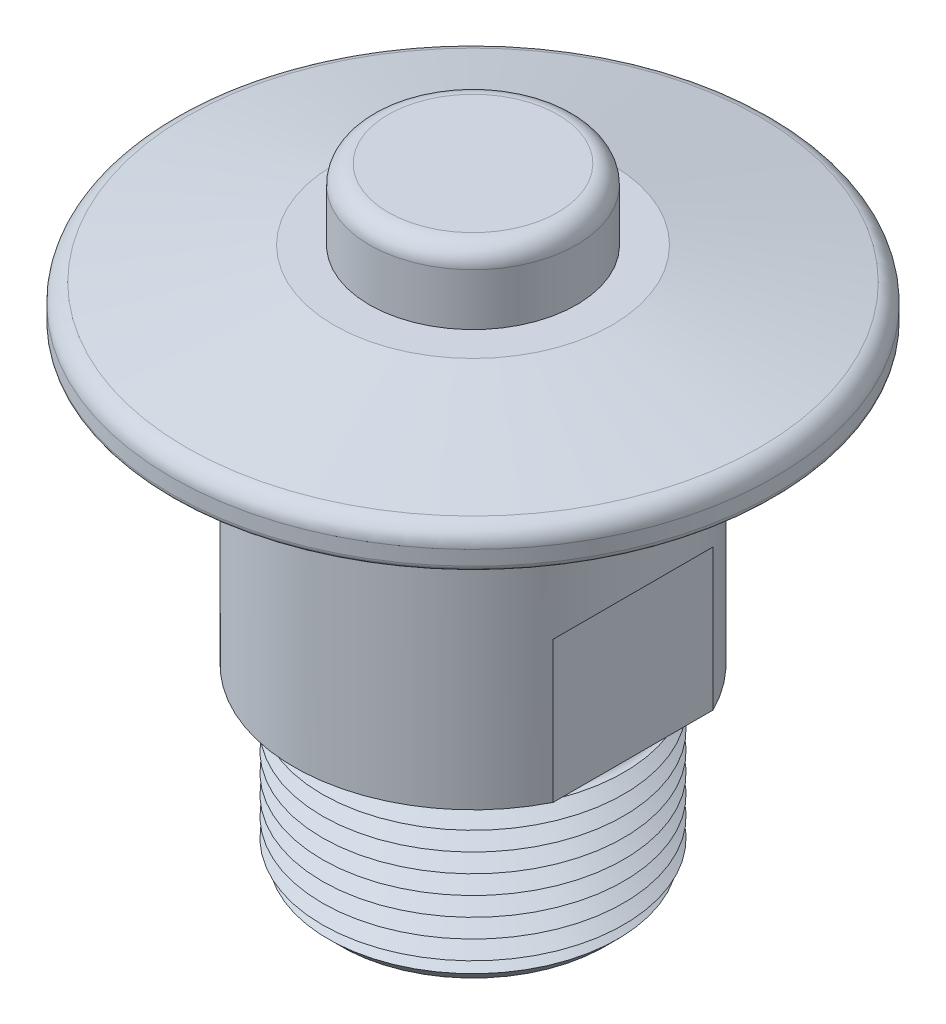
SolidWorks part; units mm, degrees
ref_plane "Front Plane" through (0, 0, 0) normal (0, 0, 1) x (1, 0, 0)
ref_plane "Top Plane" through (0, 0, 0) normal (0, 1, 0) x (1, 0, 0)
ref_plane "Right Plane" through (0, 0, 0) normal (1, 0, 0) x (0, 0, -1)
sketch "Sketch2" plane through (0, 0, 0) normal (0, 1, 0) x (1, 0, 0)
  circle A0 centre (0, 0) radius 9.5
  dimension "D1" = 19
extrude "Boss-Extrude1" add sketch "Sketch2" against normal blind 15.5
sketch "Sketch5" plane through (0, -15.5, 0) normal (0, -1, 0) x (1, 0, 0)
  circle A0 centre (0, 0) radius 8
  dimension "D1" = 16
extrude "Boss-Extrude3" add sketch "Sketch5" along normal blind 9.5
chamfer "Chamfer1" distance 1 angle 45 1 edges at (0, -25, -8)
sketch "Sketch7" plane through (0, 0, 0) normal (1, 0, 0) x (0, 0, -1)
  line L0 (0, -2.3362) -> (0, -32.4373) construction
sketch "Sketch9" plane through (0, 0, 0) normal (1, 0, 0) x (0, 0, -1)
  line L0 (-8, -15.5) -> (-8, -24) construction
  line L1 (-8, -15.5) -> (-8, -16.5)
  arc A0 (-8, -16.5) -> (-8, -15.5) centre (-8, -16) ccw
  point P1 (-8, -15.5)
  point P7 (-8, -15.5)
  dimension "D1" = 1
revolve "Cut-Revolve1" cut sketch "Sketch9" angle 360 about L0
sketch "Sketch10" plane through (0, 0, 0) normal (1, 0, 0) x (0, 0, -1)
  line L0 (-8, -16.5) -> (-7.134, -17)
  line L1 (-7.134, -17) -> (-8, -17.5)
  line L2 (-8, -16.5) -> (-8, -24) construction
  line L3 (-8, -17.5) -> (-8, -16.5)
  dimension "D1" = 1
revolve "Cut-Revolve2" cut sketch "Sketch10" angle 360 about L0
pattern_linear "LPattern1" count 8 spacing 1 along (0, -1, 0) of "Cut-Revolve2"
sketch "Sketch11" plane through (0, -25, 0) normal (0, -1, 0) x (1, 0, 0)
  circle A0 centre (0, 0) radius 3
  dimension "D1" = 6
extrude "Cut-Extrude2" cut sketch "Sketch11" against normal blind 6
chamfer "Chamfer3" distance 0.5 angle 45 1 edges at (0, -25, -3)
sketch "Sketch12" plane through (0, -19, 0) normal (0, -1, 0) x (1, 0, 0)
  circle A0 centre (0, 0) radius 3
  circle A1 centre (0, 0) radius 3 construction
extrude "Cut-Extrude3" cut sketch "Sketch12" against normal through all draft 30
ref_plane "Plane1" through (0, -22, 0) normal (0, -1, 0) x (-1, 0, 0)
sketch "Sketch14" plane through (0, -22, 0) normal (0, -1, 0) x (-1, 0, 0)
  line L0 (-2, 0) -> (-4, 0)
  arc A0 (-2, 0) -> (-4, 0) centre (-3, 0) ccw
  circle A1 centre (0, 0) radius 3 construction
  circle A2 centre (0, 0) radius 3 construction
  point P2 (-3, 0)
  point P8 (-3, 0)
  dimension "D1" = 2
revolve "Revolve2" add sketch "Sketch14" angle 360 about L0
pattern_circular "CirPattern1" count 4 over 360 about axis through (0, 0, 0) along (0, 1, 0) of "Revolve2"
sketch "Sketch15" plane through (0, 0, 0) normal (1, 0, 0) x (0, 0, -1)
  line L0 (0, 0) -> (-16, 0)
  line L1 (-16, 0) -> (-16, 1.875)
  line L2 (-16, 1.875) -> (-7.375, 3.75)
  line L3 (-7.375, 3.75) -> (-5.5, 3.75)
  line L4 (-5.5, 3.75) -> (-5.5, 7.5)
  line L5 (-5.5, 7.5) -> (0, 7.5)
  line L6 (0, 7.5) -> (0, 0)
  line L7 (0, -2.3362) -> (0, -32.4373) construction
  dimension "D1" = 16
  dimension "D2" = 7.5
  dimension "D3" = 3.75
  dimension "D4" = 5.5
  dimension "D5" = 1.875
revolve "Revolve3" add sketch "Sketch15" angle 360 about L0
fillet "Fillet1" radius 1 2 edges at (0, 7.5, 5.5) (0, 1.875, 16)
fillet "Fillet2" radius 0.3 1 edges at (0, 0, 16)
sketch "Sketch16" plane through (0, -15.5, 0) normal (0, -1, 0) x (1, 0, 0)
  line L0 (-8.5, 4.2426) -> (-8.5, -4.2426)
  line L2 (8.5, -4.2426) -> (8.5, 4.2426)
  arc A0 (-8.5, 4.2426) -> (-8.5, -4.2426) centre (0, 0) ccw
  circle A1 centre (0, 0) radius 9.5 construction
  arc A2 (8.5, -4.2426) -> (8.5, 4.2426) centre (0, 0) ccw
  dimension "D1" = 17
extrude "Cut-Extrude4" cut sketch "Sketch16" against normal blind 8.5
fillet "Fillet3" radius 2 1 edges at (0, 0, 9.5)
chamfer "Chamfer4" distance 1 angle 45 2 edges at (8.5, -7, 0) (-8.5, -7, 0)
